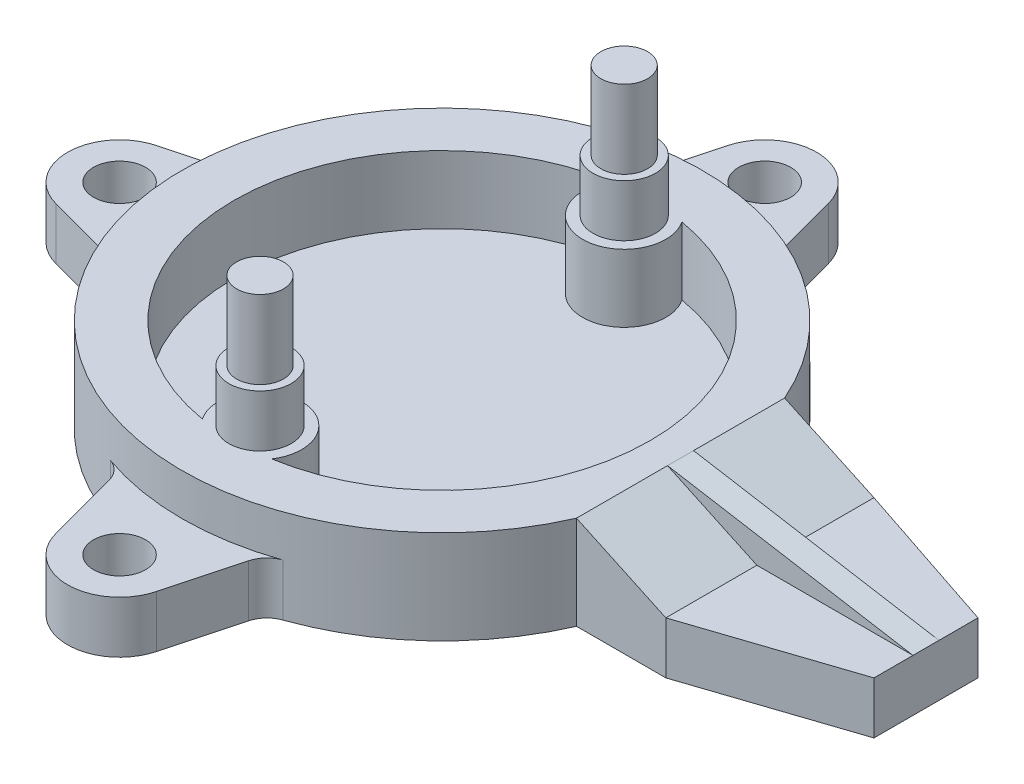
SolidWorks part; units mm, degrees
ref_plane "Front Plane" through (0, 0, 0) normal (0, 0, 1) x (1, 0, 0)
ref_plane "Top Plane" through (0, 0, 0) normal (0, 1, 0) x (1, 0, 0)
ref_plane "Right Plane" through (0, 0, 0) normal (1, 0, 0) x (0, 0, -1)
sketch "Sketch1" plane through (0, 0, 0) normal (0, 1, 0) x (1, 0, 0)
  circle A0 centre (0, 0) radius 50
  dimension "D1" = 100
extrude "Boss-Extrude1" add sketch "Sketch1" along normal blind 18
sketch "Sketch2" plane through (0, 18, 0) normal (0, 1, 0) x (1, 0, 0)
  circle A0 centre (0, 0) radius 40
  dimension "D1" = 80
extrude "Cut-Extrude1" cut sketch "Sketch2" against normal blind 13
sketch "Sketch3" plane through (0, 18, 0) normal (0, 1, 0) x (1, 0, 0)
  line L0 (0, 0) -> (109.7264, 0) construction
  line L1 (45.8258, 20) -> (63, 20)
  line L2 (63, 20) -> (93, 10)
  line L3 (93, 10) -> (93, -10)
  line L4 (93, -10) -> (63, -20)
  line L5 (63, -20) -> (45.8258, -20)
  circle A0 centre (0, 0) radius 50 construction
  arc A1 (45.8258, -20) -> (45.8258, 20) centre (0, 0) ccw
  dimension "D1" = 40
  dimension "D2" = 20
  dimension "D3" = 93
  dimension "D4" = 30
extrude "Boss-Extrude10" add sketch "Sketch3" against normal up to surface (18 mm away)
sketch "Sketch4" plane through (0, 0, 0) normal (0, 0, 1) x (1, 0, 0)
  line L0 (45.8258, 18) -> (63, 10)
  line L1 (63, 0) -> (63, 18) construction
  line L2 (63, 10) -> (93, 10)
  line L3 (93, 0) -> (93, 18) construction
  line L4 (93, 10) -> (93, 18)
  line L5 (93, 18) -> (45.8258, 18)
  line L6 (93, 0) -> (63, 0) construction
  dimension "D1" = 10
extrude "Cut-Extrude2" cut sketch "Sketch4" against normal through all both and the other way through all
sketch "Sketch5" plane through (0, 0, 0) normal (0, 0, 1) x (1, 0, 0)
  line L0 (93, 10) -> (45.8258, 18)
rib "Rib1" sketch "Sketch5" sketch "Sketch5" thickness 5 extrusion direction parallel to sketch draft on no parameters "D1"=5
sketch "Sketch6" plane through (0, 18, 0) normal (0, 1, 0) x (1, 0, 0)
  line L0 (0, 0) -> (27.2134, 0) construction
  circle A0 centre (0, 35) radius 8
  circle A1 centre (0, -35) radius 8
  dimension "D1" = 16
  dimension "D2" = 35
extrude "Boss-Extrude11" add sketch "Sketch6" against normal up to next
sketch "Sketch7" plane through (0, 18, 0) normal (0, 1, 0) x (1, 0, 0)
  circle A0 centre (0, 35) radius 6
  circle A1 centre (0, -35) radius 6
  dimension "D1" = 12
extrude "Boss-Extrude12" add sketch "Sketch7" along normal blind 10
sketch "Sketch8" plane through (0, 28, 0) normal (0, 1, 0) x (1, 0, 0)
  circle A0 centre (0, 35) radius 4.5
  circle A1 centre (0, -35) radius 4.5
  dimension "D1" = 9
extrude "Boss-Extrude13" add sketch "Sketch8" along normal blind 15
sketch "Sketch9" plane through (0, 0, 0) normal (0, -1, 0) x (1, 0, 0)
  line L0 (0, 0) -> (-78.3672, 0) construction
  line L1 (-47.9669, 14.1129) -> (-64.5882, 9.6593)
  line L2 (-64.5882, -9.6593) -> (-47.9669, -14.1129)
  arc A0 (45.8258, 20) -> (45.8258, -20) centre (0, 0) ccw construction
  arc A1 (-47.9669, 14.1129) -> (-47.9669, -14.1129) centre (0, 0) ccw
  arc A2 (-64.5882, 9.6593) -> (-64.5882, -9.6593) centre (-62, 0) ccw
  circle A3 centre (-62, 0) radius 5
  dimension "D2" = 10
  dimension "D3" = 10
  dimension "D1" = 30
  dimension "D4" = 62
extrude "Boss-Extrude14" add sketch "Sketch9" against normal blind 10
pattern_circular "CirPattern1" count 4 over 360 about axis through (0, 0, 0) along (0, 1, 0) of "Boss-Extrude14"
fillet "Fillet1" radius 5 6 edges at (14.1129, 5, -47.9669) (-14.1129, 5, -47.9669) (-47.9669, 5, -14.1129) (-47.9669, 5, 14.1129) (-14.1129, 5, 47.9669) (14.1129, 5, 47.9669)
